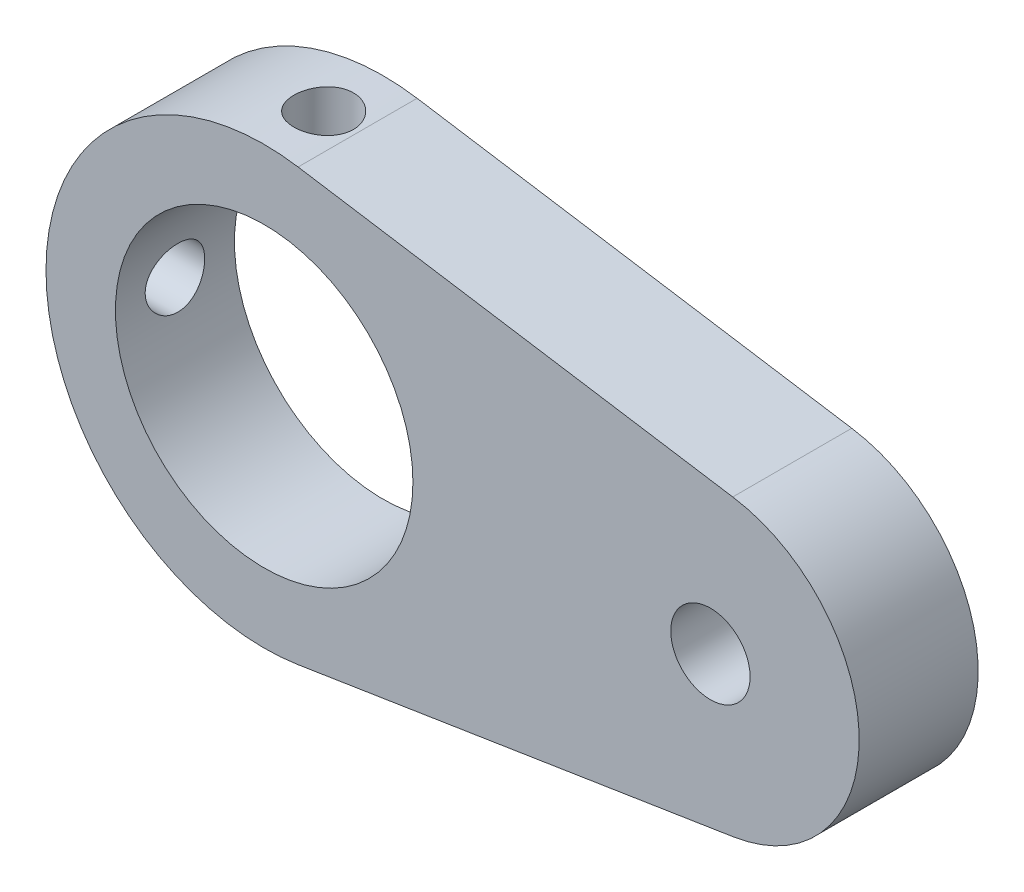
SolidWorks part; units mm, degrees
ref_plane "前视基准面" through (0, 0, 0) normal (0, 0, 1) x (1, 0, 0)
ref_plane "上视基准面" through (0, 0, 0) normal (0, 1, 0) x (1, 0, 0)
ref_plane "右视基准面" through (0, 0, 0) normal (1, 0, 0) x (0, 0, -1)
sketch "草图1" plane through (0, 0, 0) normal (0, 0, 1) x (1, 0, 0)
  line L0 (0, 0) -> (45, 0) construction
  line L1 (47.2503, -14.8302) -> (3.4223, -21.7322)
  line L2 (47.2503, 14.8302) -> (3.4223, 21.7322)
  circle A0 centre (0, 0) radius 15
  arc A1 (3.4223, 21.7322) -> (3.4223, -21.7322) centre (0, 0) ccw
  circle A2 centre (45, 0) radius 4
  arc A3 (47.2503, -14.8302) -> (47.2503, 14.8302) centre (45, 0) ccw
  dimension "D1" = 8
extrude "凸台-拉伸1" add sketch "草图1" along normal blind 12
ref_plane "基准面1" through (0, 22, 0) normal (0, 1, 0) x (1, 0, 0)
sketch "草图2" plane through (0, 22, 0) normal (0, 1, 0) x (1, 0, 0)
  line L0 (0, 0) -> (0, -12) construction
  circle A0 centre (0, -6) radius 3
extrude "切除-拉伸1" cut sketch "草图2" against normal blind 10
ref_plane "基准面2" through (-22, 0, 0) normal (1, 0, 0) x (0, 0, -1)
sketch "草图3" plane through (-22, 0, 0) normal (1, 0, 0) x (0, 0, -1)
  line L0 (0, 0) -> (-12, 0) construction
  circle A0 centre (-6, 0) radius 3
extrude "切除-拉伸2" cut sketch "草图3" along normal blind 13
